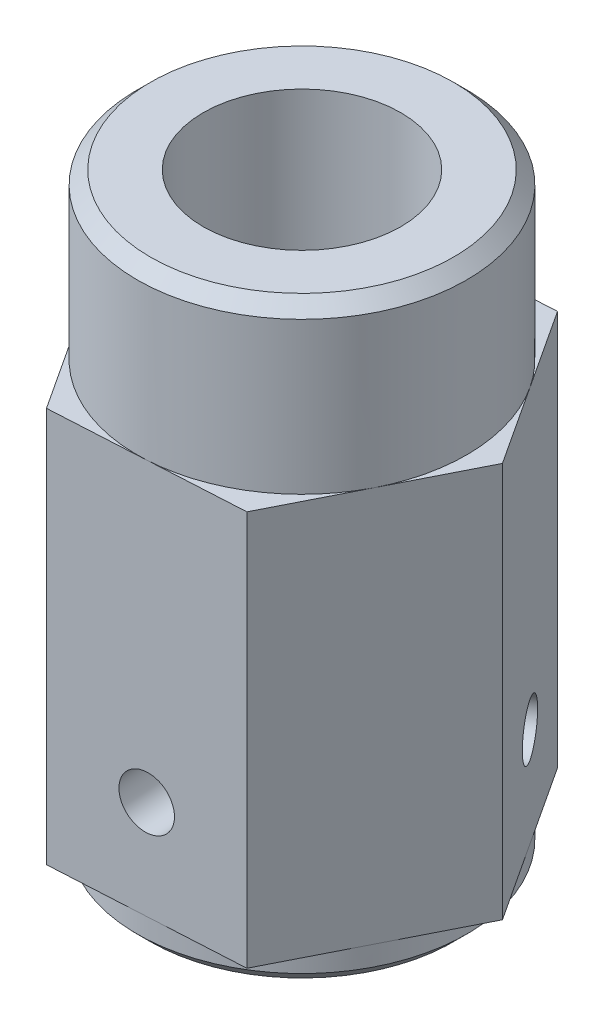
SolidWorks part; units mm, degrees
ref_plane "前视基准面" through (0, 0, 0) normal (0, 0, 1) x (1, 0, 0)
ref_plane "上视基准面" through (0, 0, 0) normal (0, 1, 0) x (1, 0, 0)
ref_plane "右视基准面" through (0, 0, 0) normal (1, 0, 0) x (0, 0, -1)
sketch "草图1" plane through (0, 0, 0) normal (0, 1, 0) x (1, 0, 0)
  line L1 (-13.0231, -25.763) -> (15.7999, -24.1598)
  line L2 (15.7999, -24.1598) -> (28.823, 1.6032)
  line L3 (28.823, 1.6032) -> (13.0231, 25.763)
  line L4 (13.0231, 25.763) -> (-15.7999, 24.1598)
  line L5 (-15.7999, 24.1598) -> (-28.823, -1.6032)
  line L6 (-28.823, -1.6032) -> (-13.0231, -25.763)
  circle A0 centre (0, 0) radius 25 construction
extrude "凸台-拉伸1" add sketch "草图1" along normal blind 60
sketch "草图2" plane through (0, 60, 0) normal (0, 1, 0) x (1, 0, 0)
  circle A0 centre (0, 0) radius 25
extrude "凸台-拉伸2" add sketch "草图2" along normal blind 25
sketch "草图3" plane through (0, 0, 0) normal (0, -1, 0) x (1, 0, 0)
  circle A0 centre (0, 0) radius 25
extrude "凸台-拉伸3" add sketch "草图3" along normal blind 5
sketch "草图4" plane through (0, -5, 0) normal (0, -1, 0) x (1, 0, 0)
  circle A0 centre (0, 0) radius 12.5
extrude "切除-拉伸1" cut sketch "草图4" against normal blind 45
sketch "草图5" plane through (0, 85, 0) normal (0, 1, 0) x (1, 0, 0)
  circle A0 centre (0, 0) radius 15
extrude "切除-拉伸2" cut sketch "草图5" against normal blind 45
sketch "草图6" plane through (-22.3114, 0, -11.2783) normal (-0.8925, 0, -0.4511) x (-0.4511, 0, 0.8925)
  line L0 (-25, -5) -> (25, -5) construction
  circle A0 centre (0, 15) radius 4
  dimension "D1" = 20
extrude "切除-拉伸3" cut sketch "草图6" against normal blind 17
sketch "草图7" plane through (20.923, 0, -13.6831) normal (0.8369, 0, -0.5473) x (-0.5473, 0, -0.8369)
  line L0 (-25, -5) -> (25, -5) construction
  circle A0 centre (0, 15) radius 4
  dimension "D1" = 20
extrude "切除-拉伸4" cut sketch "草图7" against normal blind 17
sketch "草图8" plane through (1.3884, 0, 24.9614) normal (0.0555, 0, 0.9985) x (0.9985, 0, -0.0555)
  line L0 (-25, -5) -> (25, -5) construction
  circle A0 centre (0, 15) radius 4
  dimension "D1" = 20
extrude "切除-拉伸5" cut sketch "草图8" against normal blind 17
chamfer "倒角1" distance 2 angle 45 2 edges at (0, -5, -25) (0, 85, 25)
